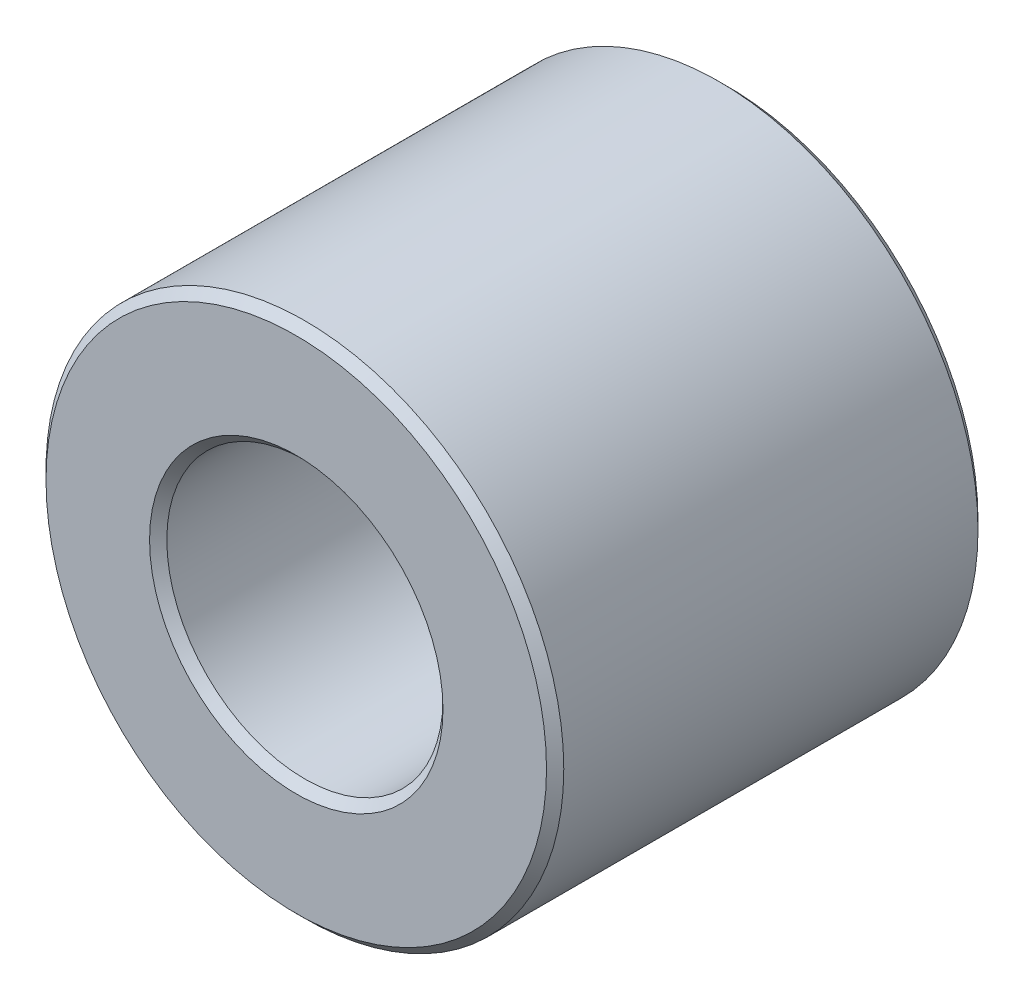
SolidWorks part; units mm, degrees
ref_plane "Front Plane" through (0, 0, 0) normal (0, 0, 1) x (1, 0, 0)
ref_plane "Top Plane" through (0, 0, 0) normal (0, 1, 0) x (1, 0, 0)
ref_plane "Right Plane" through (0, 0, 0) normal (1, 0, 0) x (0, 0, -1)
sketch "Sketch1" plane through (0, 0, 0) normal (0, 0, 1) x (1, 0, 0)
  circle A0 centre (0, 0) radius 3
  circle A1 centre (0, 0) radius 1.6
  dimension "D1" = 6
  dimension "D2" = 3.2
extrude "Boss-Extrude2" add sketch "Sketch1" along normal mid plane 5
chamfer "Chamfer3" distance 0.1 angle 45 4 edges at (3, 0, 2.5) (3, 0, -2.5) (1.6, 0, -2.5) (1.6, 0, 2.5)
